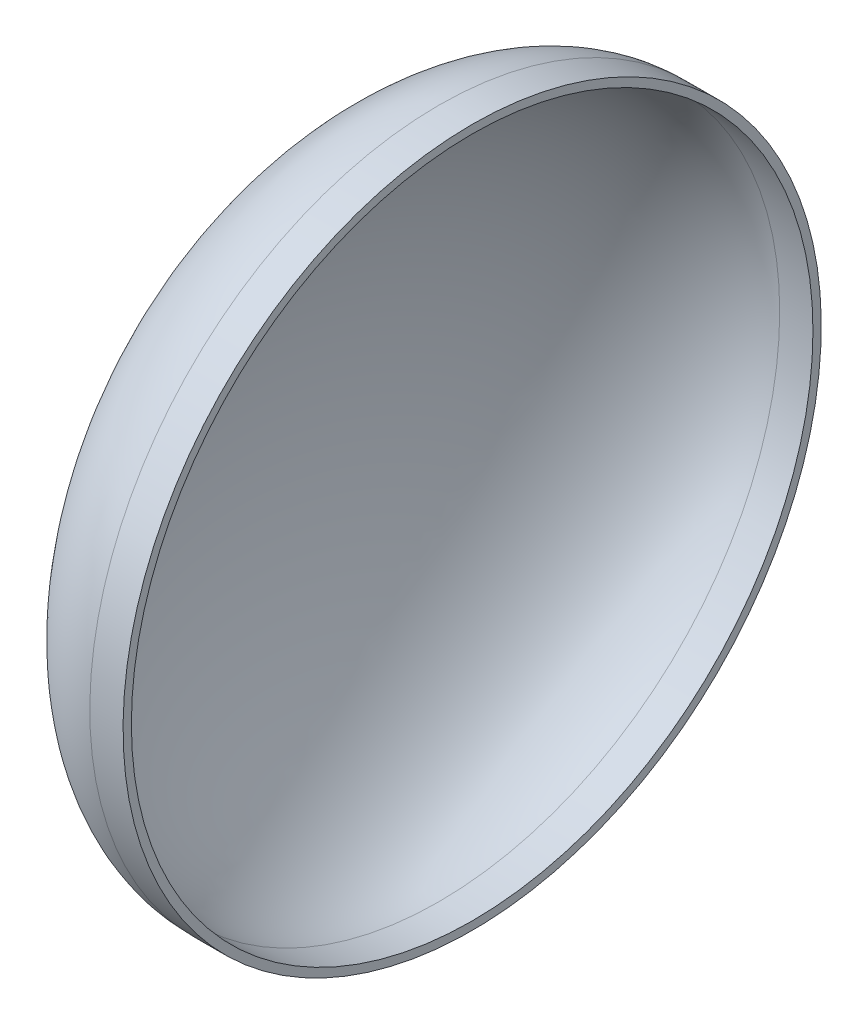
SolidWorks part; units mm, degrees
ref_plane "Front Plane" through (0, 0, 0) normal (0, 0, 1) x (1, 0, 0)
ref_plane "Top Plane" through (0, 0, 0) normal (0, 1, 0) x (1, 0, 0)
ref_plane "Right Plane" through (0, 0, 0) normal (1, 0, 0) x (0, 0, -1)
sketch "Sketch1" plane through (0, 0, 0) normal (0, 0, 1) x (1, 0, 0)
  line L0 (-1828.8, 533.4) -> (-1828.8, 520.7) construction
  line L1 (-1879.6, 520.7) -> (-1828.8, 520.7) construction
  line L2 (-2152.65, 0) -> (-2139.95, 0) construction
  line L3 (-1879.6, 533.4) -> (-1828.8, 533.4) construction
  line L4 (-1828.8, 533.4) -> (-1828.8, 520.7)
  line L5 (-1879.6, 520.7) -> (-1828.8, 520.7)
  line L6 (-2152.65, 0) -> (-2139.95, 0)
  line L7 (-1879.6, 533.4) -> (-1828.8, 533.4)
  line L8 (-1879.6, 0) -> (-2152.65, 0) construction
  line L9 (-1879.6, 0) -> (-2152.65, 0) construction
  ellipse E0 centre (-1879.6, 0) end of major axis (-1879.6, 533.4) minor radius 273.05 (-1879.6, 533.4) -> (-2152.65, 0) ccw construction
  ellipse E1 centre (-1879.6, 0) end of major axis (-1879.6, 533.4) minor radius 273.05 (-1879.6, 533.4) -> (-2152.65, 0) ccw
  spline S0 degree 3 poles (9584.6616, -5434.4855) (-1047.6611, -1569.3976) (-1467.3419, 581.4322) (-1908.0273, 517.9715) (-1928.2977, 512.1077) (-1952.4534, 500.3038) (-1984.1361, 478.1847) (-2022.0537, 438.6874) (-2062.5345, 373.86) (-2096.032, 294.1752) (-2116.8678, 218.0502) (-2128.7561, 153.1417) (-2135.1935, 102.9448) (-2138.4344, 60.2634) (-2170.7393, -795.2431) (-1174.2759, -1747.2738) (962.2105, 12404.975) knots -5.130525 -5.130525 -5.130525 -5.130525 0.049087 0.098175 0.19635 0.294524 0.392699 0.589049 0.785398 0.981748 1.178097 1.276272 1.374447 1.472622 1.521709 6.257813 6.257813 6.257813 6.257813 only from (-1879.6, 520.7) to (-2139.95, 0) construction
  spline S1 degree 3 poles (-1879.6, 520.7) (-1883.6662, 520.7) (-1891.7836, 520.3106) (-1908.0273, 517.9715) (-1928.2977, 512.1077) (-1952.4534, 500.3038) (-1984.1361, 478.1847) (-2022.0537, 438.6874) (-2062.5345, 373.86) (-2096.032, 294.1752) (-2116.8678, 218.0502) (-2128.7561, 153.1417) (-2135.1935, 102.9448) (-2138.4344, 60.2634) (-2139.7333, 25.8654) (-2139.95, 8.6185) (-2139.95, 0) knots 0 0 0 0 0.049087 0.098175 0.19635 0.294524 0.392699 0.589049 0.785398 0.981748 1.178097 1.276272 1.374447 1.472622 1.521709 1.570796 1.570796 1.570796 1.570796
revolve "Revolve1" add sketch "Sketch1" angle 360 about L9
